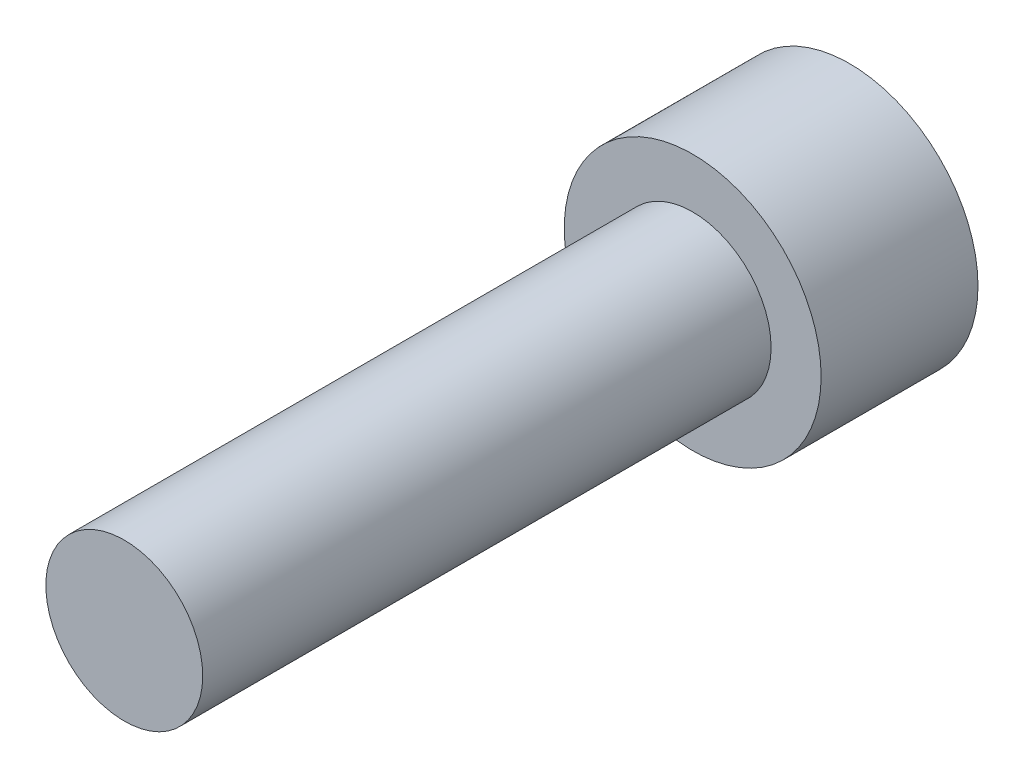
SolidWorks part; units mm, degrees
ref_plane "Front Plane" through (0, 0, 0) normal (0, 0, 1) x (1, 0, 0)
ref_plane "Top Plane" through (0, 0, 0) normal (0, 1, 0) x (1, 0, 0)
ref_plane "Right Plane" through (0, 0, 0) normal (1, 0, 0) x (0, 0, -1)
sketch "Sketch6" plane through (0, 0, 0) normal (1, 0, 0) x (0, 0, -1)
  line L0 (-12.7, 0) -> (22.525, 0) construction
  line L1 (3.1572, 0) -> (-3.1572, 0) construction
  line L2 (-12.7, 0) -> (-12.7, -1.7526)
  line L3 (-12.7, -1.7526) -> (0, -1.7526)
  line L4 (0, 3.1572) -> (0, -3.1572) construction
  line L5 (0, -1.7526) -> (0, -2.8702)
  line L6 (0, -2.8702) -> (3.5052, -2.8702)
  line L7 (3.5052, -2.8702) -> (3.5052, 0)
  line L8 (3.5052, 0) -> (-12.7, 0)
  dimension "L" = 12.7
  dimension "H" = 3.5052
  dimension "A" = 5.7404
  dimension "D" = 3.5052
revolve "Revolve1" add sketch "Sketch6" angle 360 about L0
sketch "Sketch7" plane through (0, 0, -3.5052) normal (0, 0, -1) x (-1, 0, 0)
  line L2 (-1.3843, 0.7992) -> (-1.3843, -0.7992)
  line L4 (-1.3843, -0.7992) -> (0, -1.5985)
  line L5 (0, -1.5985) -> (1.3843, -0.7992)
  line L6 (1.3843, -0.7992) -> (1.3843, 0.7992)
  line L7 (1.3843, 0.7992) -> (0, 1.5985)
  line L8 (0, 1.5985) -> (-1.3843, 0.7992)
  circle A0 centre (0, 0) radius 1.3843 construction
  dimension "J" = 2.7686
extrude "HEX" cut sketch "Sketch7" against normal blind 2.032
